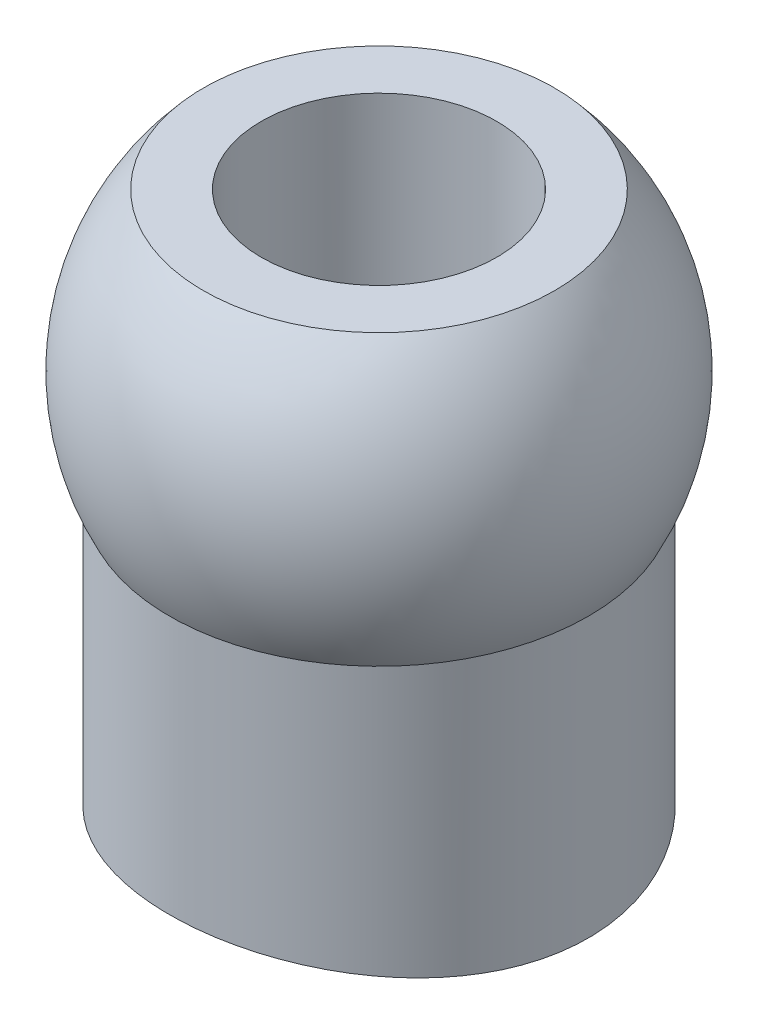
SolidWorks part; units mm, degrees
ref_plane "Face" through (0, 0, 0) normal (0, 0, 1) x (1, 0, 0)
ref_plane "Dessus" through (0, 0, 0) normal (0, 1, 0) x (1, 0, 0)
ref_plane "Droite" through (0, 0, 0) normal (1, 0, 0) x (0, 0, -1)
sketch "Esquisse1" plane through (0, 0, 0) normal (0, 0, 1) x (1, 0, 0)
  line L0 (0, 52.8709) -> (0, -27) construction
  line L1 (0, 3) -> (3.3541, 3)
  line L2 (0, -7.3845) -> (4, -7.3845)
  line L3 (0, -7.3845) -> (0, 3)
  line L5 (4, -7.3845) -> (4, -2.0616)
  arc A0 (4, -2.0616) -> (3.3541, 3) centre (0, 0) ccw
  dimension "D1" = 10.3845
  dimension "D3" = 9
  dimension "D2" = 8
  dimension "D4" = 27
  dimension "D5" = 30
revolve "Révolution1" add sketch "Esquisse1" angle 360 about L0
sketch "Esquisse2" plane through (0, 0, 0) normal (0, 0, 1) x (1, 0, 0)
  circle A0 centre (0, -28) radius 21
  dimension "D1" = 42
extrude "Enlèv. mat.-Extru.1" cut sketch "Esquisse2" against normal through all and the other way through all
hole_wizard "Dégagement M41" positions "Esquisse4" profile "Esquisse3" hole size "M4" standard "ISO"
sketch "Esquisse4" plane through (0, 3, 0) normal (0, 1, 0) x (-1, 0, 0)
  circle A0 centre (0, 0) radius 3.3541 construction
  point P0 (0, 0)
sketch "Esquisse3" plane through (0, 3, 0) normal (1, 0, 0) x (0, 0, 1)
  line L0 (0, 0) -> (0, 10.6158)
  line L1 (0, 10.6158) -> (2.25, 10.6158)
  line L2 (2.25, 10.6158) -> (2.25, 0)
  line L5 (2.25, 0) -> (0, 0)
  line L11 (0, -6.35) -> (0, 107.95) construction
  dimension "Diamètre du perçage jusqu'au prochain" = 4.5
  dimension "Profondeur du perçage jusqu'au prochain" = 10.6158
